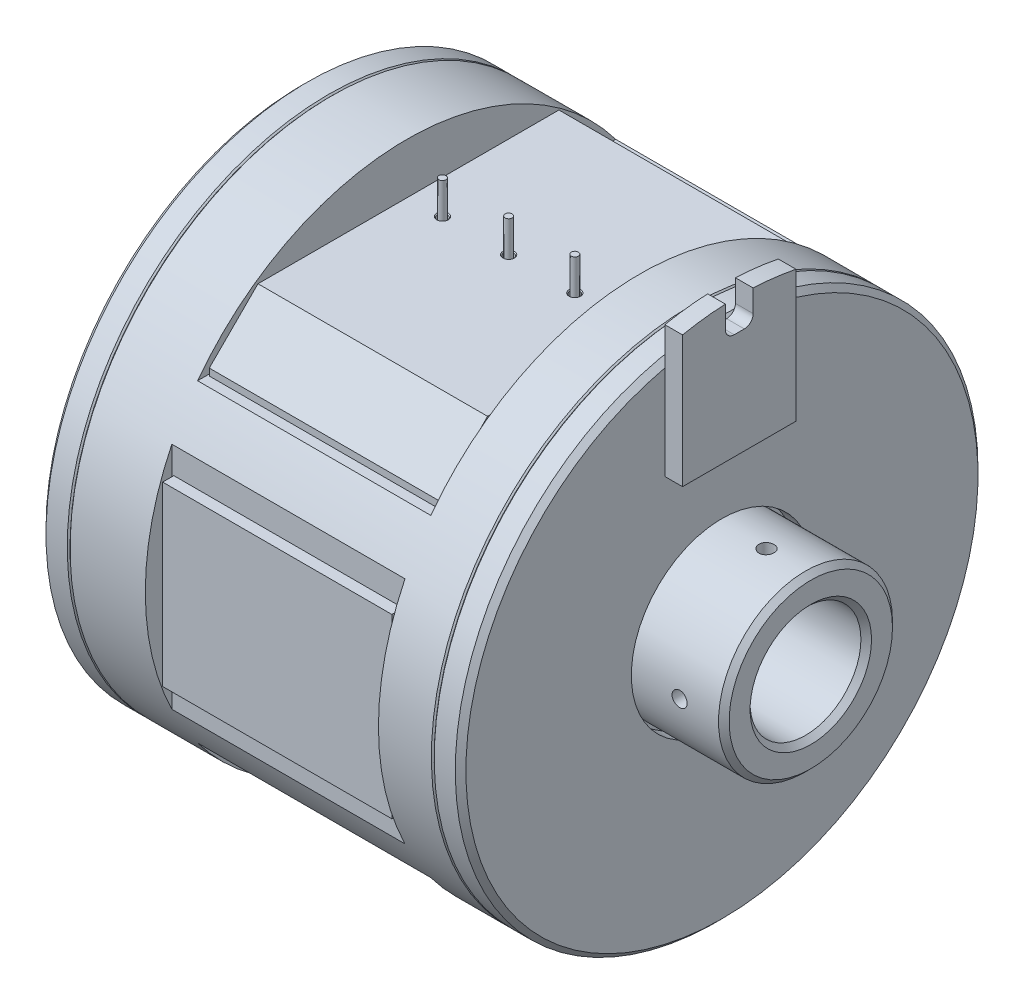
SolidWorks part; units mm, degrees
ref_plane "Front Plane" through (0, 0, 0) normal (0, 0, 1) x (1, 0, 0)
ref_plane "Top Plane" through (0, 0, 0) normal (0, 1, 0) x (1, 0, 0)
ref_plane "Right Plane" through (0, 0, 0) normal (1, 0, 0) x (0, 0, -1)
imported_body "Imported3"
sketch "Sketch1" plane through (60.2488, 0, 0) normal (1, 0, 0) x (0, 0, -1)
  line L0 (9.525, 36.7411) -> (9.525, 22.86)
  line L1 (9.525, 22.86) -> (-9.525, 22.86)
  line L2 (-9.525, 22.86) -> (-9.525, 36.7411)
  line L3 (-9.525, 36.7411) -> (9.525, 36.7411)
extrude "Boss-Extrude1" add sketch "Sketch1" along normal blind 3.175
sketch "Sketch2" plane through (0, 36.7411, 0) normal (0, 1, 0) x (-1, 0, 0)
  line L0 (-60.2488, -9.525) -> (-63.4238, -9.525)
  line L1 (-63.4238, -9.525) -> (-63.4238, 9.525)
  line L2 (-63.4238, 9.525) -> (-60.2488, 9.525)
  line L3 (-60.2488, 9.525) -> (-60.2488, -9.525)
extrude "Boss-Extrude2" add sketch "Sketch2" along normal blind 24.2189
sketch "Sketch3" plane through (3.81, 0, 0) normal (-1, 0, 0) x (0, 0, 1)
  circle A0 centre (0, 0) radius 37.5031
extrude "Boss-Extrude3" add sketch "Sketch3" along normal blind 3.81
sketch "Sketch4" plane through (60.2488, 0, 0) normal (-1, 0, 0) x (0, 0, 1)
  line L0 (-4.7625, 60.96) -> (-4.7625, 50.4825)
  line L1 (4.7625, 50.4825) -> (4.7625, 60.96)
  line L2 (4.7625, 60.96) -> (-4.7625, 60.96)
  arc A0 (-4.7625, 50.4825) -> (4.7625, 50.4825) centre (0, 50.4825) ccw
extrude "Cut-Extrude1" cut sketch "Sketch4" against normal through all
ref_plane "Plane1" through (15.0114, 0, 0) normal (-1, 0, 0) x (0, -1, 0)
sketch "Sketch5" plane through (15.0114, 0, 0) normal (-1, 0, 0) x (0, -1, 0)
  line L0 (-16.4699, 33.6931) -> (16.4699, 33.6931)
  arc A0 (16.4699, 33.6931) -> (-16.4699, 33.6931) centre (0, 0) ccw
extrude "Cut-Extrude2" cut sketch "Sketch5" against normal blind 33.4518
sketch "Sketch6" plane through (0, 0, 33.6931) normal (0, 0, 1) x (1, 0, 0)
  line L0 (48.1838, 12.7) -> (48.1838, -12.7)
  line L1 (48.1838, -12.7) -> (15.2908, -12.7)
  line L2 (15.2908, -12.7) -> (15.2908, 12.7)
  line L3 (15.2908, 12.7) -> (48.1838, 12.7)
extrude "Boss-Extrude4" add sketch "Sketch6" along normal blind 1.6002
ref_plane "Plane2" through (48.4632, 0, 0) normal (1, 0, 0) x (0, 0, -1)
sketch "Sketch7" plane through (48.4632, 0, 0) normal (1, 0, 0) x (0, 0, -1)
  line L0 (33.6931, 16.4699) -> (33.6931, -16.4699)
  arc A0 (33.6931, -16.4699) -> (33.6931, 16.4699) centre (0, 0) ccw
extrude "Cut-Extrude3" cut sketch "Sketch7" against normal blind 33.4518
sketch "Sketch8" plane through (0, 0, -33.6931) normal (0, 0, -1) x (-1, 0, 0)
  line L0 (-48.1838, -12.7) -> (-48.1838, 12.7)
  line L1 (-48.1838, 12.7) -> (-15.2908, 12.7)
  line L2 (-15.2908, 12.7) -> (-15.2908, -12.7)
  line L3 (-15.2908, -12.7) -> (-48.1838, -12.7)
extrude "Boss-Extrude5" add sketch "Sketch8" along normal blind 1.6002
hole_wizard "M36 Clearance Hole1" positions "Sketch10" profile "Sketch9" hole size "M36" standard "Ansi Metric"
sketch "Sketch10" plane through (0, 0, 0) normal (-1, 0, 0) x (0, 0, 1)
  point P0 (0, 0)
sketch "Sketch9" plane through (0, 0, 0) normal (0, 1, 0) x (0, 0, 1)
  line L0 (0, 0) -> (0, 2.286)
  line L1 (0, 2.286) -> (20.4978, 2.286)
  line L2 (20.4978, 2.286) -> (20.4978, 0)
  line L5 (20.4978, 0) -> (0, 0)
  line L10 (0, 2.286) -> (-20.4978, 2.286) construction
  line L11 (0, -6.35) -> (0, 107.95) construction
  dimension "Hole Dia." = 40.9956
  dimension "Hole Depth" = 2.286
  dimension "Drill Angle" = 180
sketch "Sketch11" plane through (2.286, 0, 0) normal (-1, 0, 0) x (0, 0, 1)
  circle A0 centre (0, 0) radius 19.9771
extrude "Boss-Extrude6" add sketch "Sketch11" along normal blind 2.286
hole_wizard "M2 Clearance Hole1" positions "Sketch13" profile "Sketch12" hole size "M2" standard "Ansi Metric"
sketch "Sketch13" plane through (0, 0, 0) normal (-1, 0, 0) x (0, 0, 1)
  point P0 (-12.9893, -7.4994)
sketch "Sketch12" plane through (0, -7.4994, -12.9893) normal (0, 1, 0) x (0, 0, 1)
  line L0 (0, 0) -> (0, 1.524)
  line L1 (0, 1.524) -> (1.1811, 1.524)
  line L2 (1.1811, 1.524) -> (1.1811, 0)
  line L5 (1.1811, 0) -> (0, 0)
  line L10 (0, 1.524) -> (-1.1811, 1.524) construction
  line L11 (0, -6.35) -> (0, 107.95) construction
  dimension "Hole Dia." = 2.3622
  dimension "Hole Depth" = 1.524
  dimension "Drill Angle" = 180
hole_wizard "M2 Clearance Hole2" positions "Sketch15" profile "Sketch14" hole size "M2" standard "Ansi Metric"
sketch "Sketch15" plane through (0, 0, 0) normal (-1, 0, 0) x (0, 0, 1)
  point P0 (12.9893, -7.4994)
sketch "Sketch14" plane through (0, -7.4994, 12.9893) normal (0, 1, 0) x (0, 0, 1)
  line L0 (0, 0) -> (0, 1.524)
  line L1 (0, 1.524) -> (1.1811, 1.524)
  line L2 (1.1811, 1.524) -> (1.1811, 0)
  line L5 (1.1811, 0) -> (0, 0)
  line L10 (0, 1.524) -> (-1.1811, 1.524) construction
  line L11 (0, -6.35) -> (0, 107.95) construction
  dimension "Hole Dia." = 2.3622
  dimension "Hole Depth" = 1.524
  dimension "Drill Angle" = 180
hole_wizard "M2 Clearance Hole3" positions "Sketch17" profile "Sketch16" hole size "M2" standard "Ansi Metric"
sketch "Sketch17" plane through (0, 0, 0) normal (-1, 0, 0) x (0, 0, 1)
  point P0 (0, 14.9987)
sketch "Sketch16" plane through (0, 14.9987, 0) normal (0, 1, 0) x (0, 0, 1)
  line L0 (0, 0) -> (0, 1.524)
  line L1 (0, 1.524) -> (1.1811, 1.524)
  line L2 (1.1811, 1.524) -> (1.1811, 0)
  line L5 (1.1811, 0) -> (0, 0)
  line L10 (0, 1.524) -> (-1.1811, 1.524) construction
  line L11 (0, -6.35) -> (0, 107.95) construction
  dimension "Hole Dia." = 2.3622
  dimension "Hole Depth" = 1.524
  dimension "Drill Angle" = 180
hole_wizard "M2 Clearance Hole4" positions "Sketch19" profile "Sketch18" hole size "M2" standard "Ansi Metric"
sketch "Sketch19" plane through (0, 0, 0) normal (-1, 0, 0) x (0, 0, 1)
  point P0 (12.9893, 7.4994)
sketch "Sketch18" plane through (0, 7.4994, 12.9893) normal (0, 1, 0) x (0, 0, 1)
  line L0 (0, 0) -> (0, 1.524)
  line L1 (0, 1.524) -> (1.1811, 1.524)
  line L2 (1.1811, 1.524) -> (1.1811, 0)
  line L5 (1.1811, 0) -> (0, 0)
  line L10 (0, 1.524) -> (-1.1811, 1.524) construction
  line L11 (0, -6.35) -> (0, 107.95) construction
  dimension "Hole Dia." = 2.3622
  dimension "Hole Depth" = 1.524
  dimension "Drill Angle" = 180
hole_wizard "M2 Clearance Hole5" positions "Sketch21" profile "Sketch20" hole size "M2" standard "Ansi Metric"
sketch "Sketch21" plane through (0, 0, 0) normal (-1, 0, 0) x (0, 0, 1)
  point P0 (0, -14.9987)
sketch "Sketch20" plane through (0, -14.9987, 0) normal (0, 1, 0) x (0, 0, 1)
  line L0 (0, 0) -> (0, 1.524)
  line L1 (0, 1.524) -> (1.1811, 1.524)
  line L2 (1.1811, 1.524) -> (1.1811, 0)
  line L5 (1.1811, 0) -> (0, 0)
  line L10 (0, 1.524) -> (-1.1811, 1.524) construction
  line L11 (0, -6.35) -> (0, 107.95) construction
  dimension "Hole Dia." = 2.3622
  dimension "Hole Depth" = 1.524
  dimension "Drill Angle" = 180
hole_wizard "M2 Clearance Hole6" positions "Sketch23" profile "Sketch22" hole size "M2" standard "Ansi Metric"
sketch "Sketch23" plane through (0, 0, 0) normal (-1, 0, 0) x (0, 0, 1)
  point P0 (-12.9893, 7.4994)
sketch "Sketch22" plane through (0, 7.4994, -12.9893) normal (0, 1, 0) x (0, 0, 1)
  line L0 (0, 0) -> (0, 1.524)
  line L1 (0, 1.524) -> (1.1811, 1.524)
  line L2 (1.1811, 1.524) -> (1.1811, 0)
  line L5 (1.1811, 0) -> (0, 0)
  line L10 (0, 1.524) -> (-1.1811, 1.524) construction
  line L11 (0, -6.35) -> (0, 107.95) construction
  dimension "Hole Dia." = 2.3622
  dimension "Hole Depth" = 1.524
  dimension "Drill Angle" = 180
hole_wizard "M24 Clearance Hole1" positions "Sketch25" profile "Sketch24" hole size "M24" standard "Ansi Metric"
sketch "Sketch25" plane through (60.2488, 0, 0) normal (1, 0, 0) x (0, 0, -1)
  point P0 (0, 0)
sketch "Sketch24" plane through (60.2488, 0, 0) normal (0, 1, 0) x (0, 0, -1)
  line L0 (0, 0) -> (0, 2.286)
  line L1 (0, 2.286) -> (13.0048, 2.286)
  line L2 (13.0048, 2.286) -> (13.0048, 0)
  line L5 (13.0048, 0) -> (0, 0)
  line L10 (0, 2.286) -> (-13.0048, 2.286) construction
  line L11 (0, -6.35) -> (0, 107.95) construction
  dimension "Hole Dia." = 26.0096
  dimension "Hole Depth" = 2.286
  dimension "Drill Angle" = 180
sketch "Sketch26" plane through (15.0114, 0, 0) normal (-1, 0, 0) x (0, -1, 0)
  line L0 (22.5044, 30.0006) -> (22.5044, -30.0006)
  arc A0 (22.5044, -30.0006) -> (22.5044, 30.0006) centre (0, 0) ccw
extrude "Cut-Extrude4" cut sketch "Sketch26" against normal blind 33.4518
ref_plane "Plane3" through (48.2092, 0, 0) normal (1, 0, 0) x (0, 0, -1)
sketch "Sketch27" plane through (48.2092, 0, 0) normal (1, 0, 0) x (0, 0, -1)
  line L0 (-28.575, -23.495) -> (-21.59, -30.48)
  line L1 (-21.59, -30.48) -> (21.59, -30.48)
  line L2 (21.59, -30.48) -> (28.575, -23.495)
  line L3 (28.575, -23.495) -> (28.575, -22.5044)
  line L4 (28.575, -22.5044) -> (-28.575, -22.5044)
  line L5 (-28.575, -22.5044) -> (-28.575, -23.495)
extrude "Boss-Extrude7" add sketch "Sketch27" against normal blind 32.9438
hole_wizard "Hole1" positions "Sketch29" profile "Sketch28" legacy
sketch "Sketch29" plane through (0, -30.48, 0) normal (0, -1, 0) x (1, 0, 0)
  point P0 (34.3916, 0)
sketch "Sketch28" plane through (34.3916, -30.48, 0) normal (1, 0, 0) x (0, 0, -1)
  line L0 (0, 0) -> (0, 1.524)
  line L1 (0, 1.524) -> (0.6985, 1.524)
  line L2 (0.6985, 1.524) -> (0.6985, 0)
  line L3 (0.6985, 0) -> (0, 0)
  line L4 (0, 110) -> (0, -10) construction
  dimension "Diameter" = 1.397
  dimension "Depth" = 1.524
hole_wizard "Hole2" positions "Sketch31" profile "Sketch30" legacy
sketch "Sketch31" plane through (0, -30.48, 0) normal (0, -1, 0) x (1, 0, 0)
  point P0 (24.892, 0)
sketch "Sketch30" plane through (24.892, -30.48, 0) normal (1, 0, 0) x (0, 0, -1)
  line L0 (0, 0) -> (0, 1.524)
  line L1 (0, 1.524) -> (0.6985, 1.524)
  line L2 (0.6985, 1.524) -> (0.6985, 0)
  line L3 (0.6985, 0) -> (0, 0)
  line L4 (0, 110) -> (0, -10) construction
  dimension "Diameter" = 1.397
  dimension "Depth" = 1.524
hole_wizard "Hole3" positions "Sketch33" profile "Sketch32" legacy
sketch "Sketch33" plane through (0, -30.48, 0) normal (0, -1, 0) x (1, 0, 0)
  point P0 (43.8912, 0)
sketch "Sketch32" plane through (43.8912, -30.48, 0) normal (1, 0, 0) x (0, 0, -1)
  line L0 (0, 0) -> (0, 1.524)
  line L1 (0, 1.524) -> (0.6985, 1.524)
  line L2 (0.6985, 1.524) -> (0.6985, 0)
  line L3 (0.6985, 0) -> (0, 0)
  line L4 (0, 110) -> (0, -10) construction
  dimension "Diameter" = 1.397
  dimension "Depth" = 1.524
sketch "Sketch34" plane through (48.4632, 0, 0) normal (1, 0, 0) x (0, 0, -1)
  line L0 (-30.0006, 22.5044) -> (30.0006, 22.5044)
  arc A0 (30.0006, 22.5044) -> (-30.0006, 22.5044) centre (0, 0) ccw
extrude "Cut-Extrude5" cut sketch "Sketch34" against normal blind 33.4518
ref_plane "Plane4" through (15.2654, 0, 0) normal (-1, 0, 0) x (0, 0, 1)
sketch "Sketch35" plane through (15.2654, 0, 0) normal (-1, 0, 0) x (0, 0, 1)
  line L0 (28.575, 23.495) -> (21.59, 30.48)
  line L1 (21.59, 30.48) -> (-21.59, 30.48)
  line L2 (-21.59, 30.48) -> (-28.575, 23.495)
  line L3 (-28.575, 23.495) -> (-28.575, 22.5044)
  line L4 (-28.575, 22.5044) -> (28.575, 22.5044)
  line L5 (28.575, 22.5044) -> (28.575, 23.495)
extrude "Boss-Extrude8" add sketch "Sketch35" against normal blind 32.9438
hole_wizard "Hole4" positions "Sketch37" profile "Sketch36" legacy
sketch "Sketch37" plane through (0, 30.48, 0) normal (0, 1, 0) x (-1, 0, 0)
  point P0 (-29.6418, 0)
sketch "Sketch36" plane through (29.6418, 30.48, 0) normal (1, 0, 0) x (0, 0, 1)
  line L0 (0, 0) -> (0, 1.524)
  line L1 (0, 1.524) -> (0.6985, 1.524)
  line L2 (0.6985, 1.524) -> (0.6985, 0)
  line L3 (0.6985, 0) -> (0, 0)
  line L4 (0, 110) -> (0, -10) construction
  dimension "Diameter" = 1.397
  dimension "Depth" = 1.524
hole_wizard "Hole5" positions "Sketch39" profile "Sketch38" legacy
sketch "Sketch39" plane through (0, 30.48, 0) normal (0, 1, 0) x (-1, 0, 0)
  point P0 (-20.1422, 0)
sketch "Sketch38" plane through (20.1422, 30.48, 0) normal (1, 0, 0) x (0, 0, 1)
  line L0 (0, 0) -> (0, 1.524)
  line L1 (0, 1.524) -> (0.6985, 1.524)
  line L2 (0.6985, 1.524) -> (0.6985, 0)
  line L3 (0.6985, 0) -> (0, 0)
  line L4 (0, 110) -> (0, -10) construction
  dimension "Diameter" = 1.397
  dimension "Depth" = 1.524
hole_wizard "Hole6" positions "Sketch41" profile "Sketch40" legacy
sketch "Sketch41" plane through (0, 30.48, 0) normal (0, 1, 0) x (-1, 0, 0)
  point P0 (-39.1414, 0)
sketch "Sketch40" plane through (39.1414, 30.48, 0) normal (1, 0, 0) x (0, 0, 1)
  line L0 (0, 0) -> (0, 1.524)
  line L1 (0, 1.524) -> (0.6985, 1.524)
  line L2 (0.6985, 1.524) -> (0.6985, 0)
  line L3 (0.6985, 0) -> (0, 0)
  line L4 (0, 110) -> (0, -10) construction
  dimension "Diameter" = 1.397
  dimension "Depth" = 1.524
ref_plane "Plane5" through (0, 0, 0) normal (0, 0, -1) x (-1, 0, 0)
sketch "Sketch42" plane through (0, 0, 0) normal (0, 0, -1) x (-1, 0, 0)
  line L0 (-39.6494, 28.956) -> (-39.1414, 28.956)
  line L1 (-39.1414, 28.956) -> (-39.1414, 35.306)
  line L2 (-39.1414, 35.306) -> (-39.6494, 35.306)
  line L3 (-39.6494, 35.306) -> (-39.6494, 28.956)
  line L4 (-39.1414, 28.956) -> (-39.1414, 35.306) construction
revolve "Revolve1" add sketch "Sketch42" angle 360 about L4
sketch "Sketch43" plane through (0, 0, 0) normal (0, 0, -1) x (-1, 0, 0)
  line L0 (-20.6502, 28.956) -> (-20.1422, 28.956)
  line L1 (-20.1422, 28.956) -> (-20.1422, 35.306)
  line L2 (-20.1422, 35.306) -> (-20.6502, 35.306)
  line L3 (-20.6502, 35.306) -> (-20.6502, 28.956)
  line L4 (-20.1422, 28.956) -> (-20.1422, 35.306) construction
revolve "Revolve2" add sketch "Sketch43" angle 360 about L4
sketch "Sketch44" plane through (0, 0, 0) normal (0, 0, -1) x (-1, 0, 0)
  line L0 (-30.1498, 28.956) -> (-29.6418, 28.956)
  line L1 (-29.6418, 28.956) -> (-29.6418, 35.306)
  line L2 (-29.6418, 35.306) -> (-30.1498, 35.306)
  line L3 (-30.1498, 35.306) -> (-30.1498, 28.956)
  line L4 (-29.6418, 28.956) -> (-29.6418, 35.306) construction
revolve "Revolve3" add sketch "Sketch44" angle 360 about L4
sketch "Sketch45" plane through (0, 0, 0) normal (0, 0, 1) x (1, 0, 0)
  line L0 (44.3992, -28.956) -> (43.8912, -28.956)
  line L1 (43.8912, -28.956) -> (43.8912, -35.306)
  line L2 (43.8912, -35.306) -> (44.3992, -35.306)
  line L3 (44.3992, -35.306) -> (44.3992, -28.956)
  line L4 (43.8912, -28.956) -> (43.8912, -35.306) construction
revolve "Revolve4" add sketch "Sketch45" angle 360 about L4
sketch "Sketch46" plane through (0, 0, 0) normal (0, 0, 1) x (1, 0, 0)
  line L0 (25.4, -28.956) -> (24.892, -28.956)
  line L1 (24.892, -28.956) -> (24.892, -35.306)
  line L2 (24.892, -35.306) -> (25.4, -35.306)
  line L3 (25.4, -35.306) -> (25.4, -28.956)
  line L4 (24.892, -28.956) -> (24.892, -35.306) construction
revolve "Revolve5" add sketch "Sketch46" angle 360 about L4
sketch "Sketch47" plane through (0, 0, 0) normal (0, 0, 1) x (1, 0, 0)
  line L0 (34.8996, -28.956) -> (34.3916, -28.956)
  line L1 (34.3916, -28.956) -> (34.3916, -35.306)
  line L2 (34.3916, -35.306) -> (34.8996, -35.306)
  line L3 (34.8996, -35.306) -> (34.8996, -28.956)
  line L4 (34.3916, -28.956) -> (34.3916, -35.306) construction
revolve "Revolve6" add sketch "Sketch47" angle 360 about L4
sketch "Sketch48" plane through (0, 0, 0) normal (0, 0, 1) x (1, 0, 0)
  line L0 (57.9628, 12.4841) -> (57.9628, 0)
  line L1 (57.9628, 0) -> (72.9996, 0)
  line L2 (72.9996, 0) -> (72.9996, 12.4841)
  line L3 (72.9996, 12.4841) -> (57.9628, 12.4841)
  line L4 (57.9628, 0) -> (72.9996, 0) construction
revolve "Revolve7" add sketch "Sketch48" angle 360 about L4
ref_plane "Plane6" through (0, 0, -12.9893) normal (0, 0, -1) x (-1, 0, 0)
sketch "Sketch49" plane through (0, 0, -12.9893) normal (0, 0, -1) x (-1, 0, 0)
  line L0 (-1.524, 8.3503) -> (-1.524, 7.4994)
  line L1 (-1.524, 7.4994) -> (8.001, 7.4994)
  line L2 (8.001, 7.4994) -> (8.001, 8.1471)
  line L3 (8.001, 8.1471) -> (4.826, 8.1471)
  line L4 (4.826, 8.1471) -> (4.826, 8.3503)
  line L5 (4.826, 8.3503) -> (-1.524, 8.3503)
  line L6 (-1.524, 7.4994) -> (8.001, 7.4994) construction
revolve "Revolve8" add sketch "Sketch49" angle 360 about L6
sketch "Sketch50" plane through (0, 0, 0) normal (0, 0, -1) x (-1, 0, 0)
  line L0 (-1.524, -14.1478) -> (-1.524, -14.9987)
  line L1 (-1.524, -14.9987) -> (8.001, -14.9987)
  line L2 (8.001, -14.9987) -> (8.001, -14.351)
  line L3 (8.001, -14.351) -> (4.826, -14.351)
  line L4 (4.826, -14.351) -> (4.826, -14.1478)
  line L5 (4.826, -14.1478) -> (-1.524, -14.1478)
  line L6 (-1.524, -14.9987) -> (8.001, -14.9987) construction
revolve "Revolve9" add sketch "Sketch50" angle 360 about L6
ref_plane "Plane7" through (0, 0, 12.9893) normal (0, 0, -1) x (-1, 0, 0)
sketch "Sketch51" plane through (0, 0, 12.9893) normal (0, 0, -1) x (-1, 0, 0)
  line L0 (-1.524, 8.3503) -> (-1.524, 7.4994)
  line L1 (-1.524, 7.4994) -> (8.001, 7.4994)
  line L2 (8.001, 7.4994) -> (8.001, 8.1471)
  line L3 (8.001, 8.1471) -> (4.826, 8.1471)
  line L4 (4.826, 8.1471) -> (4.826, 8.3503)
  line L5 (4.826, 8.3503) -> (-1.524, 8.3503)
  line L6 (-1.524, 7.4994) -> (8.001, 7.4994) construction
revolve "Revolve10" add sketch "Sketch51" angle 360 about L6
sketch "Sketch52" plane through (0, 0, 0) normal (0, 0, -1) x (-1, 0, 0)
  line L0 (-1.524, 15.8496) -> (-1.524, 14.9987)
  line L1 (-1.524, 14.9987) -> (8.001, 14.9987)
  line L2 (8.001, 14.9987) -> (8.001, 15.6464)
  line L3 (8.001, 15.6464) -> (4.826, 15.6464)
  line L4 (4.826, 15.6464) -> (4.826, 15.8496)
  line L5 (4.826, 15.8496) -> (-1.524, 15.8496)
  line L6 (-1.524, 14.9987) -> (8.001, 14.9987) construction
revolve "Revolve11" add sketch "Sketch52" angle 360 about L6
sketch "Sketch53" plane through (0, 0, 12.9893) normal (0, 0, -1) x (-1, 0, 0)
  line L0 (-1.524, -6.6485) -> (-1.524, -7.4994)
  line L1 (-1.524, -7.4994) -> (8.001, -7.4994)
  line L2 (8.001, -7.4994) -> (8.001, -6.8517)
  line L3 (8.001, -6.8517) -> (4.826, -6.8517)
  line L4 (4.826, -6.8517) -> (4.826, -6.6485)
  line L5 (4.826, -6.6485) -> (-1.524, -6.6485)
  line L6 (-1.524, -7.4994) -> (8.001, -7.4994) construction
revolve "Revolve12" add sketch "Sketch53" angle 360 about L6
sketch "Sketch54" plane through (0, 0, -12.9893) normal (0, 0, -1) x (-1, 0, 0)
  line L0 (-1.524, -6.6485) -> (-1.524, -7.4994)
  line L1 (-1.524, -7.4994) -> (8.001, -7.4994)
  line L2 (8.001, -7.4994) -> (8.001, -6.8517)
  line L3 (8.001, -6.8517) -> (4.826, -6.8517)
  line L4 (4.826, -6.8517) -> (4.826, -6.6485)
  line L5 (4.826, -6.6485) -> (-1.524, -6.6485)
  line L6 (-1.524, -7.4994) -> (8.001, -7.4994) construction
revolve "Revolve13" add sketch "Sketch54" angle 360 about L6
hole_wizard "M13 Clearance Hole1" positions "Sketch56" profile "Sketch55" hole size "M13" standard "Ansi Metric"
sketch "Sketch56" plane through (72.9996, 0, 0) normal (1, 0, 0) x (0, 0, -1)
  point P0 (0, 0)
sketch "Sketch55" plane through (72.9996, 0, 0) normal (0, 1, 0) x (0, 0, -1)
  line L0 (0, 0) -> (0, 81.0006)
  line L1 (0, 81.0006) -> (7.9502, 81.0006)
  line L2 (7.9502, 81.0006) -> (7.9502, 0)
  line L5 (7.9502, 0) -> (0, 0)
  line L11 (0, -6.35) -> (0, 107.95) construction
  dimension "Thru Hole Dia." = 15.9004
  dimension "Thru Hole Depth" = 81.0006
hole_wizard "Hole7" positions "3DSketch1" profile "Sketch57" legacy
sketch3d "3DSketch1"
  point P0 (66.6496, 0, 12.4841)
sketch "Sketch57" plane through (66.6496, 0, 12.4841) normal (1, 0, 0) x (0, -1, 0)
  line L0 (0, 0) -> (0, 4.5339)
  line L1 (0, 4.5339) -> (1.0795, 4.5339)
  line L2 (1.0795, 4.5339) -> (1.0795, 0)
  line L3 (1.0795, 0) -> (0, 0)
  line L4 (0, 110) -> (0, -10) construction
  dimension "Diameter" = 2.159
  dimension "Depth" = 4.5339
hole_wizard "Hole8" positions "3DSketch2" profile "Sketch58" legacy
sketch3d "3DSketch2"
  point P0 (66.6496, 12.4841, 0)
sketch "Sketch58" plane through (66.6496, 12.4841, 0) normal (1, 0, 0) x (0, 0, 1)
  line L0 (0, 0) -> (0, 4.5339)
  line L1 (0, 4.5339) -> (1.0795, 4.5339)
  line L2 (1.0795, 4.5339) -> (1.0795, 0)
  line L3 (1.0795, 0) -> (0, 0)
  line L4 (0, 110) -> (0, -10) construction
  dimension "Diameter" = 2.159
  dimension "Depth" = 4.5339
chamfer "Chamfer1" distance 0.762 angle 45 5 edges at (0, 0, 37.5031) (0, 0, 7.9502) (72.9996, 0, -12.4841) (72.9996, 0, -7.9502) (0, 0, 19.9771)
chamfer "Chamfer2" distance 0.127 angle 45 12 edges at (43.8912, -30.48, -0.6985) (0, -7.4994, -11.8082) (34.3916, -30.48, -0.6985) (0, -7.4994, 14.1704) (20.1422, 30.48, 0.6985) (0, 14.9987, 1.1811) (0, 7.4994, 14.1704) (0, -14.9987, 1.1811) (24.892, -30.48, -0.6985) (0, 7.4994, -11.8082) (29.6418, 30.48, 0.6985) (39.1414, 30.48, 0.6985)
chamfer "Chamfer3" distance 1.016 angle 45 2 edges at (61.8363, 60.96, 4.7625) (61.8363, 60.96, -4.7625)
ref_plane "Plane8" through (0, 37.5031, 0) normal (0, 1, 0) x (-1, 0, 0)
sketch "Sketch59" plane through (60.2488, 0, 0) normal (1, 0, 0) x (0, 0, -1)
  circle A0 centre (0, 0) radius 22.86
  circle A1 centre (0, 0) radius 63.2889
extrude "Cut-Extrude6" cut sketch "Sketch59" along normal up to next
sketch "Sketch60" plane through (60.2488, 0, 0) normal (1, 0, 0) x (0, 0, -1)
  circle A0 centre (0, 32.6281) radius 1.875
  arc A2 (30.0006, 22.5044) -> (-30.0006, 22.5044) centre (0, 0) ccw construction
  point P4 (0, 37.5031)
  dimension "D1" = 3.7501
  dimension "D2" = 4.875
extrude "Cut-Extrude7" cut sketch "Sketch60" against normal blind 3
sketch "Sketch61" plane through (60.2488, 0, 0) normal (1, 0, 0) x (0, 0, -1)
  circle A0 centre (0, 0) radius 41.9999
sketch "Sketch62" plane through (60.2488, 0, 0) normal (1, 0, 0) x (0, 0, -1)
  line L0 (-2.0512, 41.9498) -> (-2.0512, 38.7731)
  line L2 (-8.1952, 41.1927) -> (-8.1952, 22.3264)
  line L3 (-8.1952, 22.3264) -> (8.0829, 22.3264)
  line L4 (8.0829, 41.2148) -> (8.0829, 22.3264)
  line L5 (-6.9049, 41.4285) -> (8.0829, 22.3264) construction
  line L6 (-8.1952, 22.3264) -> (6.9896, 41.4143) construction
  line L7 (-0.7812, 37.5031) -> (0.6666, 37.5031)
  line L8 (1.9366, 41.9553) -> (1.9366, 38.7731)
  line L9 (1.7005, 38.0356) -> (1.9366, 37.5031) construction
  line L10 (-2.0512, 37.5031) -> (-1.8151, 38.0356) construction
  arc A0 (8.0829, 41.2148) -> (1.9366, 41.9553) centre (0, 0) ccw
  arc A1 (0.6666, 37.5031) -> (1.9366, 38.7731) centre (0.6666, 38.7731) ccw
  arc A2 (-0.7812, 37.5031) -> (-2.0512, 38.7731) centre (-0.7812, 38.7731) cw
  arc A3 (-2.0512, 41.9498) -> (-8.1952, 41.1927) centre (0, 0) ccw
  point P0 (0, 32.6281)
  point P11 (-0.0573, 41.9999)
  dimension "D1" = 1.27
extrude "Boss-Extrude9" add sketch "Sketch62" along normal blind 2.54
